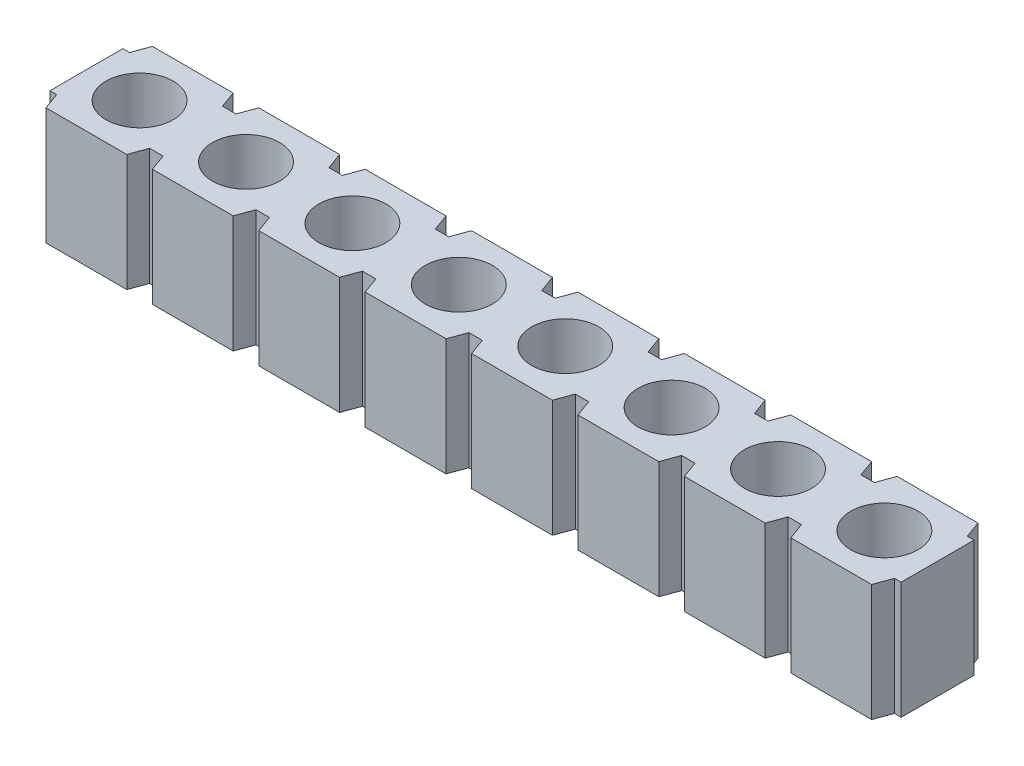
SolidWorks part; units mm, degrees
ref_plane "Front Plane" through (0, 0, 0) normal (0, 0, 1) x (1, 0, 0)
ref_plane "Top Plane" through (0, 0, 0) normal (0, 1, 0) x (1, 0, 0)
ref_plane "Right Plane" through (0, 0, 0) normal (1, 0, 0) x (0, 0, -1)
sketch "Sketch1" plane through (0, 0, 0) normal (0, 1, 0) x (1, 0, 0)
  line L0 (20.0144, 0.4) -> (19.8544, 0.4)
  line L1 (20.0144, 2.1399) -> (20.0144, 0.4)
  line L2 (-0.3056, 2.1399) -> (-0.1456, 2.1399)
  line L3 (-0.3056, 2.1399) -> (-0.3056, 0.4)
  line L4 (0, 0) -> (19.7087, 0)
  line L5 (0, 2.54) -> (-0.1456, 2.1399)
  line L6 (0, 0) -> (-0.1456, 0.4)
  line L7 (-0.3056, 0.4) -> (-0.1456, 0.4)
  line L9 (19.7087, 0) -> (19.8544, 0.4)
  line L10 (19.7087, 2.54) -> (19.8544, 2.1399)
  line L11 (20.0144, 2.1399) -> (19.8544, 2.1399)
  line L16 (19.7087, 2.54) -> (0, 2.54)
  dimension "D2" = 2.54
  dimension "D3" = 20
  dimension "D4" = 0.4
  dimension "D5" = 0.4
  dimension "D7" = 0.16
  dimension "INSLENGTH" = 20.32
extrude "Extrude1" add sketch "Sketch1" against normal blind 2.794
hole_wizard "Hole1" positions "3DSketch2" profile "Sketch3" legacy
sketch3d "3DSketch2"
  line L2 (-0.3056, 0, -2.1399) -> (-0.3056, 0, -0.4) construction
  line L3 (19.7087, 0, -2.54) -> (0, 0, -2.54) construction
  point P0 (0.9644, 0, -1.27)
  dimension "D1" = 1.27
  dimension "D2" = 1.27
sketch "Sketch3" plane through (0.9644, 0, -1.27) normal (1, 0, 0) x (0, 0, 1)
  line L0 (0, 0) -> (0, 2.794)
  line L1 (0, 2.794) -> (0.8014, 2.794)
  line L2 (0.8014, 2.794) -> (0.8014, 0)
  line L3 (0.8014, 0) -> (0, 0)
  line L4 (0, 110) -> (0, -10) construction
  dimension "Diameter" = 1.6027
  dimension "Depth" = 2.794
sketch "Sketch4" plane through (0, 0, 0) normal (0, 1, 0) x (1, 0, 0)
  line L0 (1.9288, 0) -> (2.54, 0)
  line L2 (0, 0) -> (19.7087, 0) construction
  line L5 (2.0744, 0.4) -> (1.9288, 0)
  line L6 (2.3944, 0.4) -> (2.54, 0)
  line L7 (19.7087, 2.54) -> (0, 2.54) construction
  line L8 (2.0744, 0.4) -> (2.3944, 0.4)
  line L10 (2.0744, 2.1399) -> (2.3944, 2.1399)
  line L11 (2.3944, 2.1399) -> (2.54, 2.54)
  line L12 (2.0744, 2.1399) -> (1.9288, 2.54)
  line L13 (1.9288, 2.54) -> (2.54, 2.54)
  line L17 (-0.3056, 2.1399) -> (-0.3056, 0.4) construction
  dimension "D1" = 0.4
  dimension "D2" = 0.32
  dimension "D3" = 70
  dimension "D4" = 0.6112
  dimension "D5" = 0.4001
  dimension "D6" = 2.2344
extrude "Extrude2" cut sketch "Sketch4" against normal blind 2.794
pattern_linear "LPattern1" count 8 spacing 2.54 along (1, 0, 0) of "Hole1"
pattern_linear "LPattern2" count 63 spacing 2.54 along (1, 0, 0) of "Extrude2"
